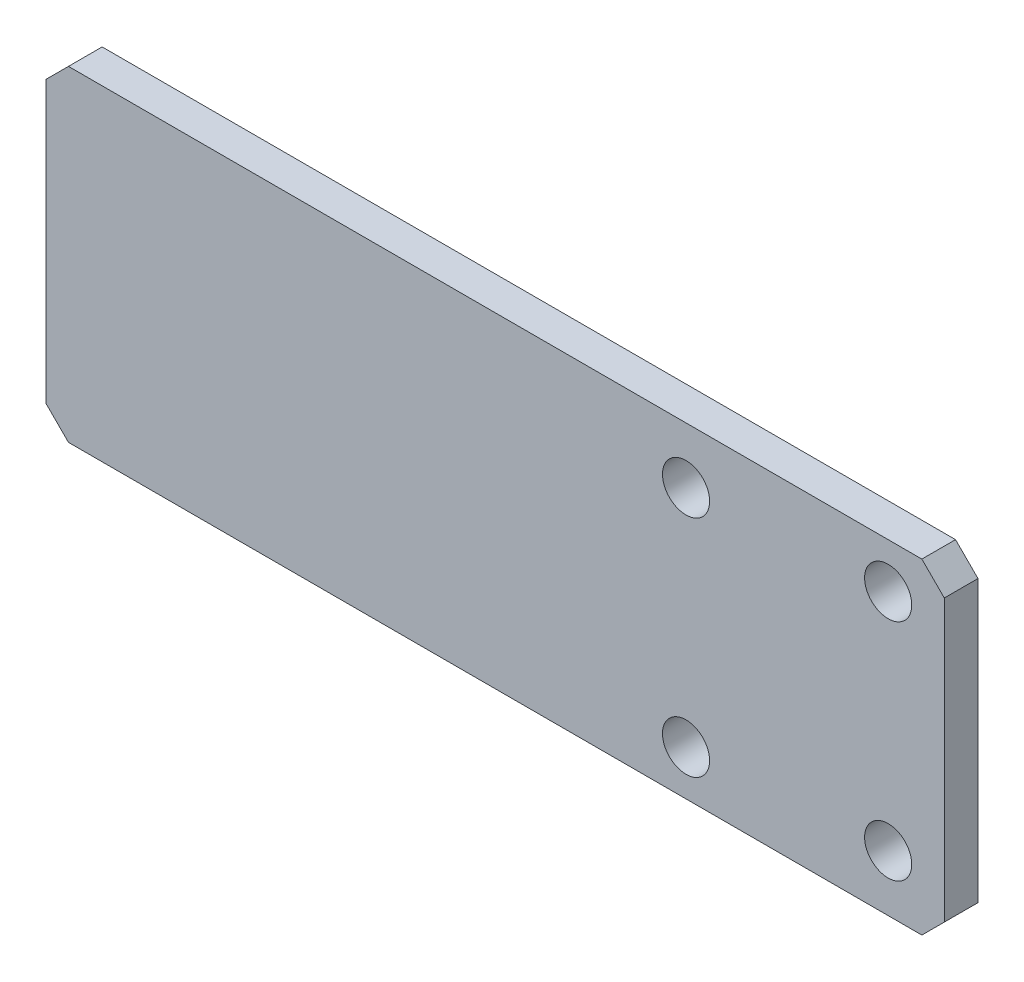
SolidWorks part; units mm, degrees
ref_plane "Plan de face" through (0, 0, 0) normal (0, 0, 1) x (1, 0, 0)
ref_plane "Plan de dessus" through (0, 0, 0) normal (0, 1, 0) x (1, 0, 0)
ref_plane "Plan de droite" through (0, 0, 0) normal (1, 0, 0) x (0, 0, -1)
sketch "Esquisse1" plane through (0, 0, 0) normal (0, 0, 1) x (1, 0, 0)
  line L1 (-30, 14) -> (50, 14)
  line L2 (-30, 14) -> (-30, -15)
  line L3 (-30, -15) -> (50, -15)
  line L4 (50, 14) -> (50, -15)
  circle A0 centre (45, 10) radius 2.1
  circle A1 centre (45, -10) radius 2.1
  circle A2 centre (27, 9) radius 2.1
  circle A3 centre (27, -11) radius 2.1
  dimension "D5" = 4.2
  dimension "D1" = 29
  dimension "D2" = 15
  dimension "D3" = 80
  dimension "D4" = 50
  dimension "D6" = 20
  dimension "D7" = 11
  dimension "D8" = 5
  dimension "D9" = 23
  dimension "D10" = 20
  dimension "D11" = 10
extrude "Extrusion1" add sketch "Esquisse1" along normal blind 3
chamfer "Chanfrein1" distance 2 angle 45 4 edges at (-30, -15, 1.5) (-30, 14, 1.5) (50, -15, 1.5) (50, 14, 1.5)
